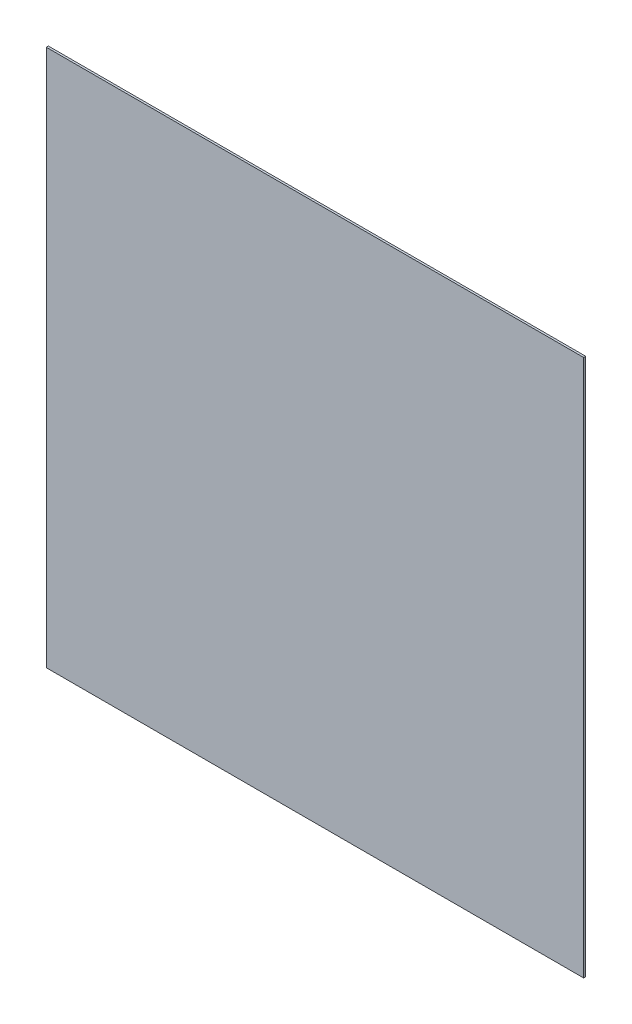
SolidWorks part; units mm, degrees
ref_plane "Front Plane" through (0, 0, 0) normal (0, 0, 1) x (1, 0, 0)
ref_plane "Top Plane" through (0, 0, 0) normal (0, 1, 0) x (1, 0, 0)
ref_plane "Right Plane" through (0, 0, 0) normal (1, 0, 0) x (0, 0, -1)
sketch "Sketch1" plane through (0, 0, 0) normal (0, 0, 1) x (1, 0, 0)
  line L1 (-412.75, -412.75) -> (412.75, -412.75)
  line L2 (-412.75, -412.75) -> (-412.75, 412.75)
  line L3 (-412.75, 412.75) -> (412.75, 412.75)
  line L4 (412.75, -412.75) -> (412.75, 412.75)
  line L5 (-412.75, -412.75) -> (412.75, 412.75) construction
  line L6 (-412.75, 412.75) -> (412.75, -412.75) construction
  point P0 (0, 0)
  dimension "D1" = 825.5
  dimension "D2" = 825.5
extrude "Extrude1" add sketch "Sketch1" along normal mid plane 3.175
